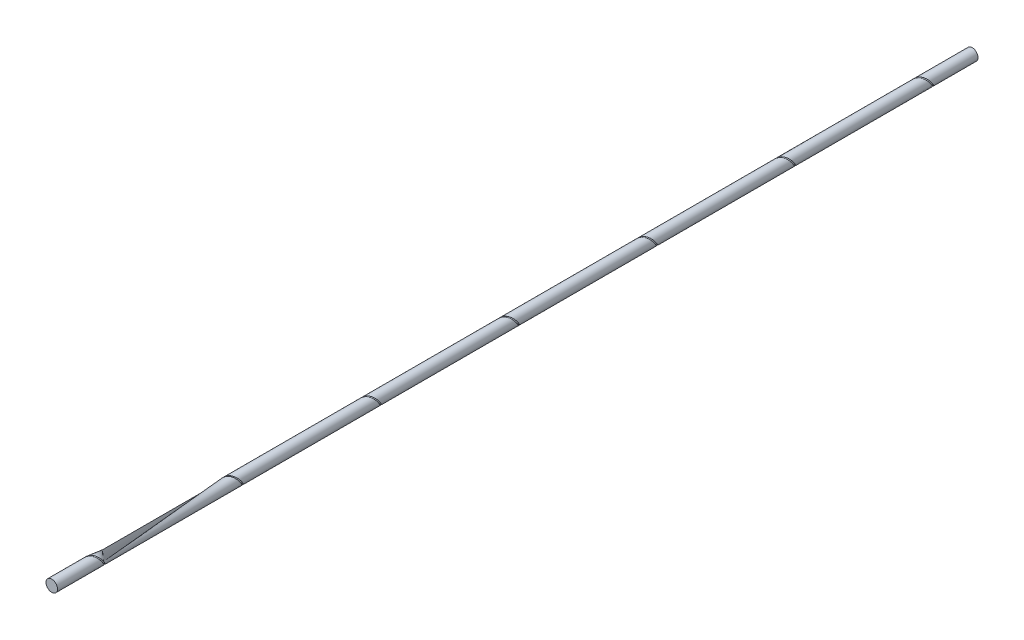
SolidWorks part; units mm, degrees
ref_plane "Front Plane" through (0, 0, 0) normal (0, 0, 1) x (1, 0, 0)
ref_plane "Top Plane" through (0, 0, 0) normal (0, 1, 0) x (1, 0, 0)
ref_plane "Right Plane" through (0, 0, 0) normal (1, 0, 0) x (0, 0, -1)
sketch "Sketch1" plane through (0, 0, 0) normal (0, 0, 1) x (1, 0, 0)
  circle A0 centre (0, 0) radius 25
  dimension "D1" = 50
extrude "Boss-Extrude1" add sketch "Sketch1" along normal blind 4000
ref_plane "Plane1" through (0, 0, 150) normal (0, 0, 1) x (1, 0, 0)
sketch "Sketch2" plane through (0, 0, 150) normal (0, 0, 1) x (1, 0, 0)
  circle A0 centre (0, 0) radius 27.646
  dimension "D1" = 55.292
curve "Helix/Spiral1"
sketch "Sketch3" plane through (0, 0, 0) normal (0, 1, 0) x (1, 0, 0)
  circle A0 centre (-27.646, -150) radius 3.969
  spline S0 degree 3 poles (-27.646, -150) (-27.646, -151.3307) (-27.0608, -154.0012) (-24.4828, -157.9997) (-20.3663, -162.0001) (-14.9702, -166) (-8.6335, -170) (-1.7543, -174) (5.2352, -178) (11.8957, -182) (17.8087, -186) (22.6028, -190) (25.9766, -194) (27.7183, -198) (27.7183, -202) (25.9766, -206) (22.6028, -210) (17.8087, -214) (11.8957, -218) (5.2352, -222) (-1.7543, -226) (-8.6335, -230) (-14.9702, -234) (-20.3663, -237.9999) (-24.4828, -242.0003) (-27.0608, -245.9988) (-27.646, -248.6693) (-27.646, -250) knots 0 0 0 0 0.04 0.08 0.12 0.16 0.2 0.24 0.28 0.32 0.36 0.4 0.44 0.48 0.52 0.56 0.6 0.64 0.68 0.72 0.76 0.8 0.84 0.88 0.92 0.96 1 1 1 1 construction
  dimension "D1" = 7.938
sweep "Cut-Sweep1" cut profiles "Sketch3" path "Helix/Spiral1"
pattern_linear "LPattern1" count 7 spacing 600 along (0, 0, -1) of "Cut-Sweep1"
